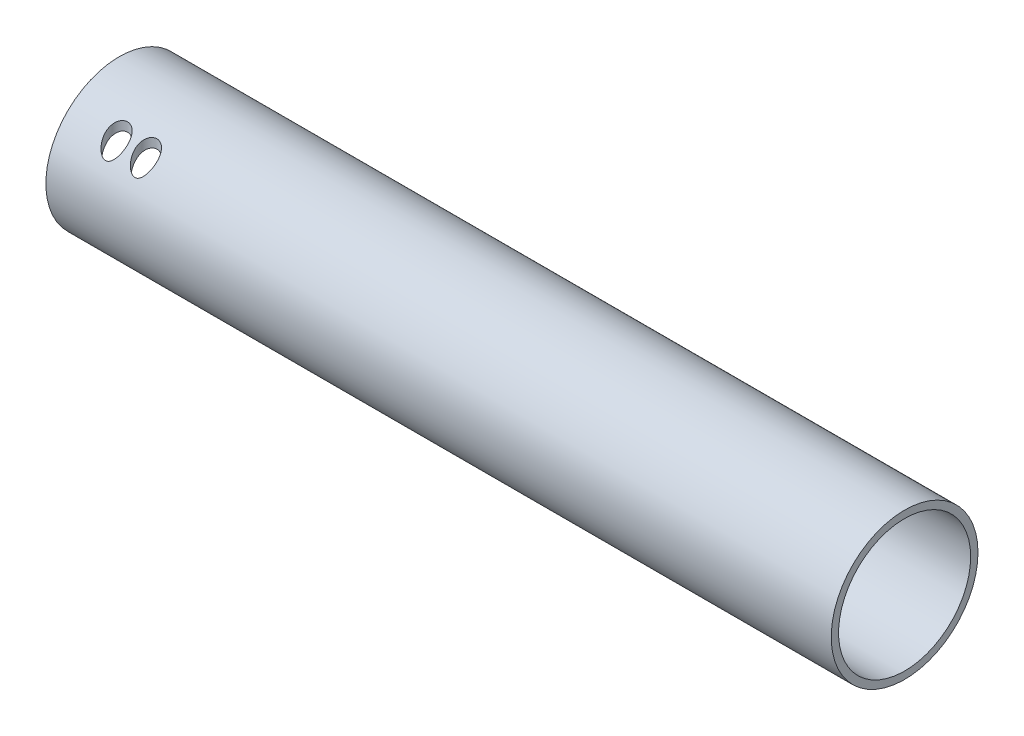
SolidWorks part; units mm, degrees
ref_plane "Front Plane" through (0, 0, 0) normal (0, 0, 1) x (1, 0, 0)
ref_plane "Top Plane" through (0, 0, 0) normal (0, 1, 0) x (1, 0, 0)
ref_plane "Right Plane" through (0, 0, 0) normal (1, 0, 0) x (0, 0, -1)
sketch "Sketch1" plane through (0, 0, 0) normal (1, 0, 0) x (0, 0, -1)
  circle A0 centre (0, 0) radius 20
extrude "Boss-Extrude1" add sketch "Sketch1" along normal blind 214
sketch "Sketch2" plane through (214, 0, 0) normal (1, 0, 0) x (0, 0, -1)
  circle A0 centre (0, 0) radius 18
extrude "Cut-Extrude1" cut sketch "Sketch2" against normal blind 214
sketch "Sketch4" plane through (0, 0, 0) normal (0, 1, 0) x (1, 0, 0)
  circle A0 centre (13.2448, -13.9751) radius 3
  circle A1 centre (21.2448, -13.9751) radius 3
  circle A3 centre (29.2448, -13.9751) radius 3
  dimension "D1" = 3
extrude "Cut-Extrude3" cut sketch "Sketch4" along normal blind 18
ref_plane "Plane1" through (0, 0, 10) normal (0, 0, 1) x (1, 0, 0)
sketch "Sketch5" plane through (0, 0, 10) normal (0, 0, 1) x (1, 0, 0)
  line L2 (163, 5) -> (178, 5)
  line L3 (163, -5) -> (178, -5)
  line L5 (160.5, -2.5) -> (160.5, 0)
  line L6 (160.5, 0) -> (160.5, 2.5)
  line L7 (180.5, 2.5) -> (180.5, -2.5)
  arc A0 (180.5, -2.5) -> (178, -5) centre (178, -2.5) cw
  arc A1 (180.5, 2.5) -> (178, 5) centre (178, 2.5) ccw
  arc A2 (163, 5) -> (160.5, 2.5) centre (163, 2.5) ccw
  arc A3 (163, -5) -> (160.5, -2.5) centre (163, -2.5) cw
  dimension "D1" = 2.5
extrude "Cut-Extrude4" cut sketch "Sketch5" against normal blind 32
